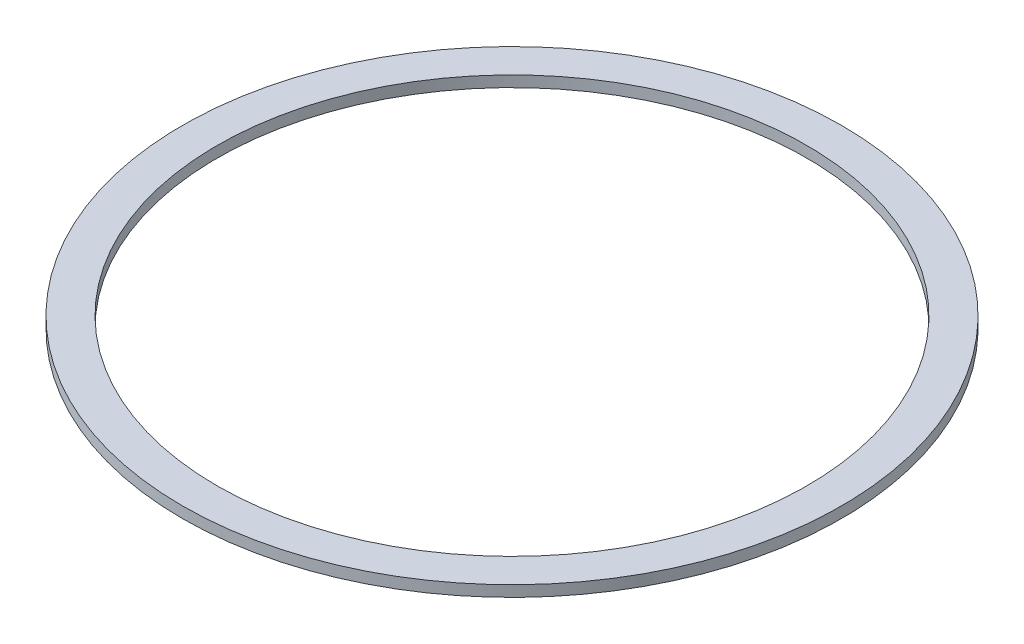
SolidWorks part; units mm, degrees
ref_plane "Front" through (0, 0, 0) normal (0, 0, 1) x (1, 0, 0)
ref_plane "Top" through (0, 0, 0) normal (0, 1, 0) x (1, 0, 0)
ref_plane "Right" through (0, 0, 0) normal (1, 0, 0) x (0, 0, -1)
sketch "Sketch1" plane through (0, 0, 0) normal (0, 1, 0) x (1, 0, 0)
  circle A0 centre (0, 0) radius 23.75
  circle A1 centre (0, 0) radius 21.25
  dimension "D1" = 47.5
  dimension "D2" = 42.5
extrude "Boss-Extrude1" add sketch "Sketch1" along normal blind 0.7937
